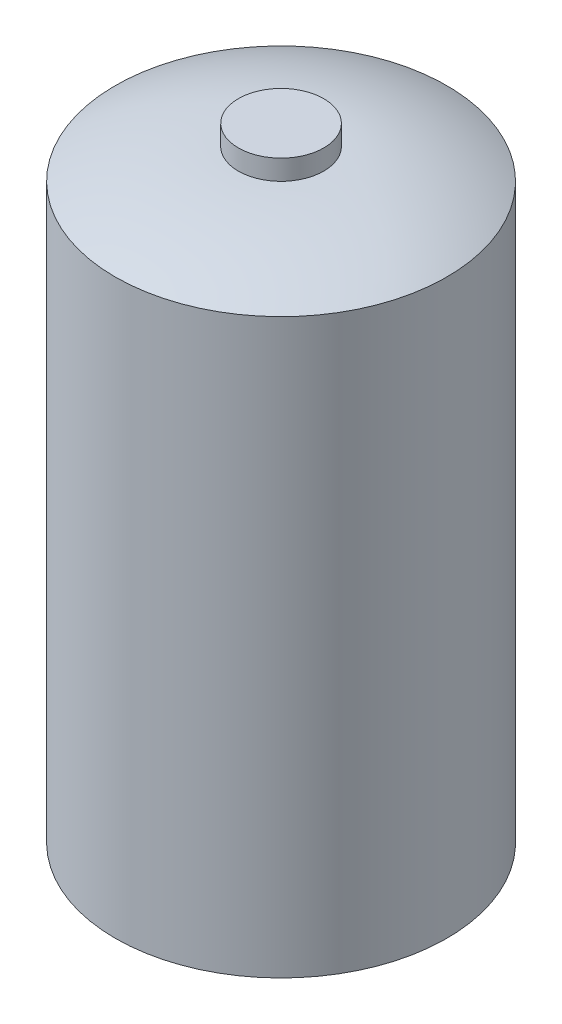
SolidWorks part; units mm, degrees
ref_plane "Face" through (0, 0, 0) normal (0, 0, 1) x (1, 0, 0)
ref_plane "Dessus" through (0, 0, 0) normal (0, 1, 0) x (1, 0, 0)
ref_plane "Droite" through (0, 0, 0) normal (1, 0, 0) x (0, 0, -1)
sketch "Esquisse1" plane through (0, 0, 0) normal (0, 0, 1) x (1, 0, 0)
  line L0 (0, 0) -> (0, -44.222) construction
  line L1 (0, 0) -> (4.25, 0)
  line L2 (4.25, 0) -> (4.25, -2)
  line L3 (0, 0) -> (0, -62)
  line L4 (0, -62) -> (16.5, -62)
  line L5 (16.5, -62) -> (16.5, -5)
  arc A0 (4.25, -2) -> (16.5, -5) centre (4.25, -28.5104) cw
  dimension "D1" = 4.25
  dimension "D2" = 62
  dimension "D3" = 57
  dimension "D4" = 16.5
  dimension "D5" = 60
revolve "Révolution1" add sketch "Esquisse1" angle 360 about L0
